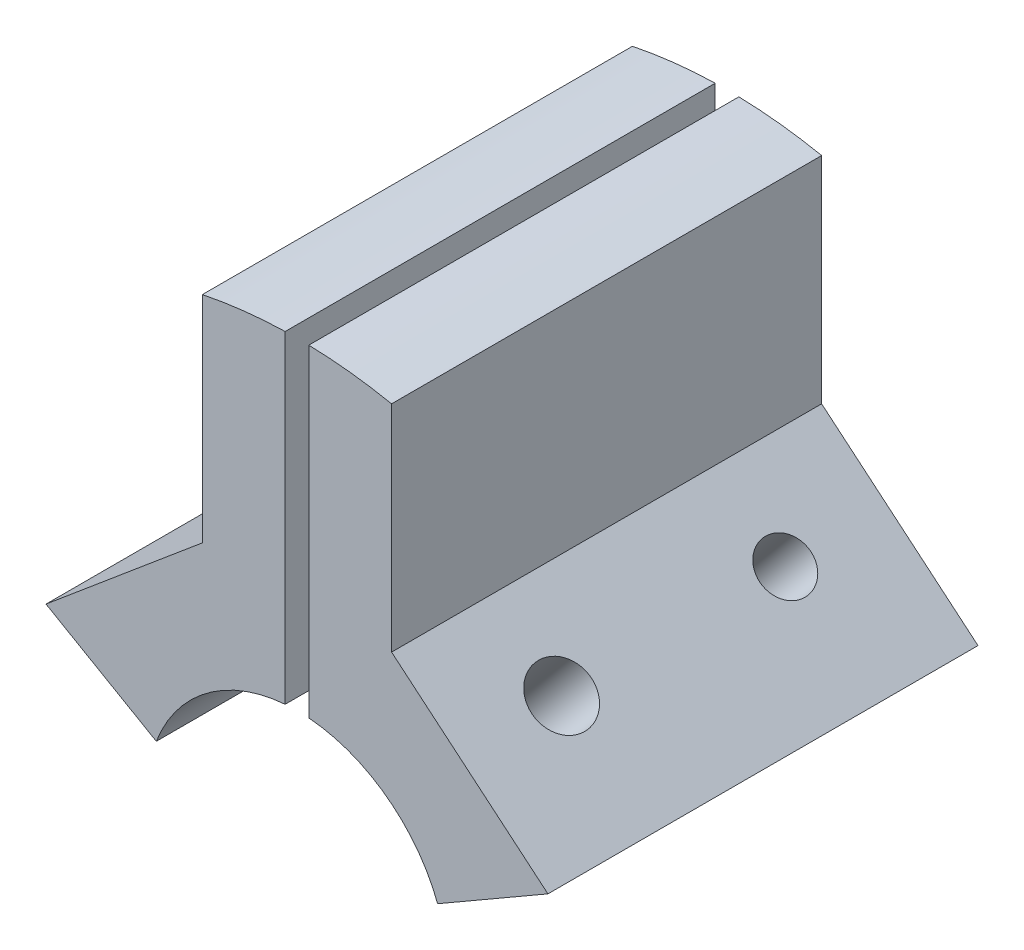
SolidWorks part; units mm, degrees
ref_plane "前视基准面" through (0, 0, 0) normal (0, 0, 1) x (1, 0, 0)
ref_plane "上视基准面" through (0, 0, 0) normal (0, 1, 0) x (1, 0, 0)
ref_plane "右视基准面" through (0, 0, 0) normal (1, 0, 0) x (0, 0, -1)
other "Configuration Table"
sketch "草图1" plane through (0, 0, 0) normal (0, 0, 1) x (1, 0, 0)
  line L0 (0, 0) -> (0, 54.4593) construction
  line L1 (-11, 53.8888) -> (-11, 28.8888)
  line L2 (-11, 28.8888) -> (-29.1784, 13.6353)
  line L3 (-29.1784, 13.6353) -> (-16.3532, 6.2307)
  line L4 (0, 0) -> (-59.3729, 0) construction
  line L5 (-1.375, 54.9828) -> (-1.375, 50.2828)
  line L6 (-1.375, 50.2828) -> (1.375, 50.2828)
  line L7 (1.375, 54.9828) -> (1.375, 50.2828)
  line L8 (11, 53.8888) -> (11, 28.8888)
  line L9 (11, 28.8888) -> (29.1784, 13.6353)
  line L10 (29.1784, 13.6353) -> (16.3532, 6.2307)
  line L11 (-1.375, 22.1459) -> (-1.375, 17.4459)
  line L12 (-1.375, 22.1459) -> (1.375, 22.1459)
  line L13 (-1.375, 50.2828) -> (-1.375, 22.1459)
  line L14 (1.375, 50.2828) -> (1.375, 22.1459)
  line L15 (1.375, 22.1459) -> (1.375, 17.4459)
  circle A0 centre (0, 0) radius 17.5
  arc A1 (11, 53.8888) -> (-11, 53.8888) centre (0, 0) ccw
  point P15 (0, 50.2828)
  point P22 (0, 22.1459)
  dimension "D1" = 110
  dimension "D2" = 35
  dimension "D8" = 4.7
  dimension "D3" = 11
  dimension "D4" = 25
  dimension "D5" = 40
  dimension "D6" = 60
  dimension "D7" = 2.75
  dimension "D9" = 4.7
extrude "凸台-拉伸1" add sketch "草图1" along normal mid plane 50 contours L5 A1 L1 L2 L3 A0 L11 L13 | L8 A1 L7 L14 L15 A0 L10 L9 | L14 L6 L13 L12
sketch "草图2" plane through (0, 50.2828, 0) normal (0, 1, 0) x (1, 0, 0)
  line L0 (1.375, -25) -> (1.375, 25) construction
  line L1 (-1.375, 25) -> (1.375, 25)
  line L2 (-1.375, 25) -> (-1.375, 20.3)
  line L3 (-1.375, 20.3) -> (1.375, 20.3)
  line L4 (1.375, 25) -> (1.375, 20.3)
  line L5 (-1.375, -25) -> (-1.375, 25) construction
  line L6 (-1.375, -20.3) -> (1.375, -20.3)
  line L7 (-1.375, -20.3) -> (-1.375, -25)
  line L8 (-1.375, -25) -> (1.375, -25)
  line L9 (1.375, -20.3) -> (1.375, -25)
  dimension "D1" = 4.7
  dimension "D2" = 4.7
extrude "切除-拉伸1" cut sketch "草图2" against normal through all
ref_plane "基准面1" through (0, 0, 13) normal (0, 0, 1) x (1, 0, 0)
ref_plane "基准面2" through (0, 0, -13) normal (0, 0, 1) x (1, 0, 0)
sketch "草图3" plane through (0, 0, 13) normal (0, 0, 1) x (1, 0, 0)
  line L0 (0, 0) -> (-24.7059, 29.4433) construction
  line L1 (0, 0) -> (0, 41.539) construction
  line L2 (0, 0) -> (23.5568, 28.074) construction
  dimension "D1" = 40
  dimension "D2" = 40
sketch "草图4" plane through (0, 0, -13) normal (0, 0, 1) x (1, 0, 0)
  line L0 (0, 0) -> (-24.7059, 29.4433) construction
  line L1 (0, 0) -> (23.5568, 28.074) construction
sketch "草图5" plane through (-18.7699, 22.3691, 0) normal (-0.6428, 0.766, 0) x (0.766, 0.6428, 0)
  line L0 (0, -13) -> (36.0912, -13) construction
  line L1 (0, 13) -> (36.0912, 13) construction
  line L2 (-15.2918, 13) -> (15.2918, 13) construction
  circle A0 centre (0, -13) radius 3
  circle A1 centre (0, 13) radius 3.5
  dimension "D1" = 6
  dimension "D2" = 7
extrude "切除-拉伸2" cut sketch "草图5" against normal through all
sketch "草图6" plane through (18.7699, 22.3691, 0) normal (0.6428, 0.766, 0) x (0.766, -0.6428, 0)
  line L0 (0, 13) -> (-37.8516, 13) construction
  line L1 (0, -13) -> (-37.8516, -13) construction
  circle A0 centre (0, 13) radius 3
  circle A1 centre (0, -13) radius 3.5
  dimension "D1" = 6
  dimension "D2" = 7
extrude "切除-拉伸3" cut sketch "草图6" against normal through all contours A1 | A0
